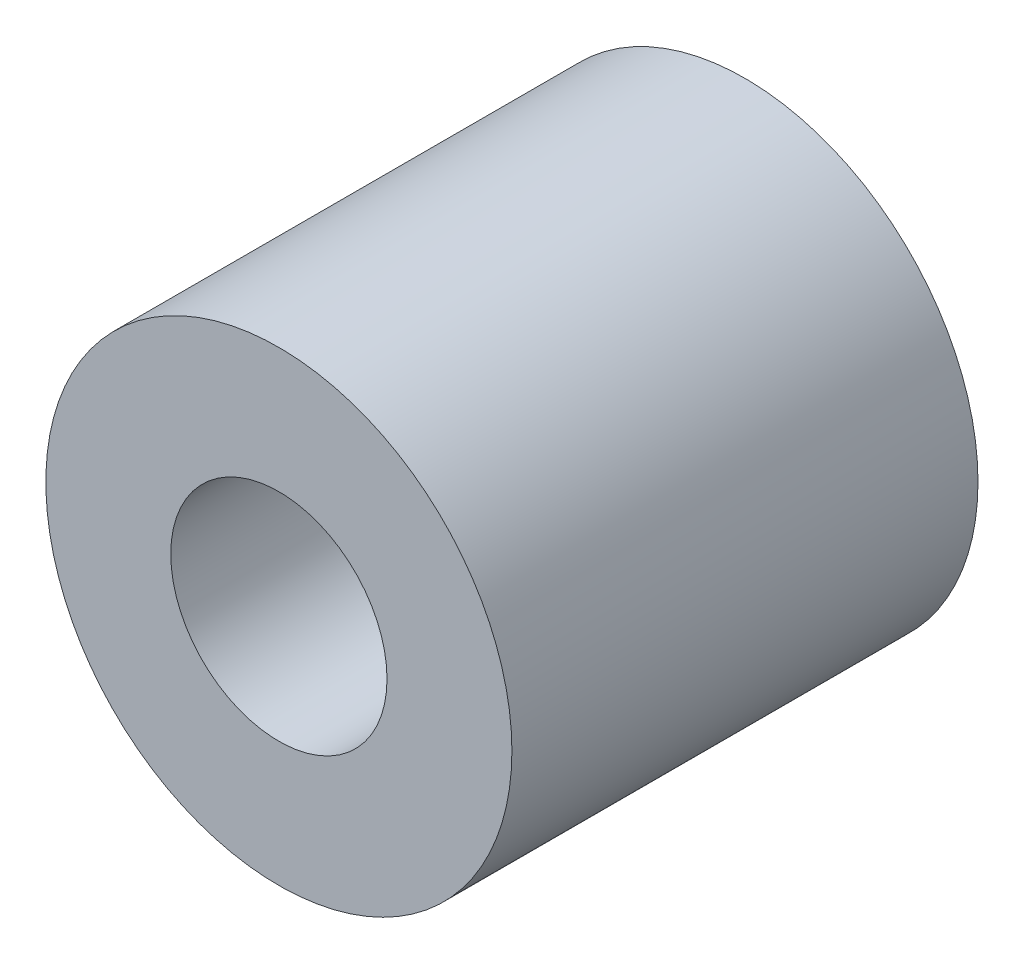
SolidWorks part; units mm, degrees
ref_plane "Front Plane" through (0, 0, 0) normal (0, 0, 1) x (1, 0, 0)
ref_plane "Top Plane" through (0, 0, 0) normal (0, 1, 0) x (1, 0, 0)
ref_plane "Right Plane" through (0, 0, 0) normal (1, 0, 0) x (0, 0, -1)
sketch "Sketch1" plane through (0, 0, 0) normal (0, 0, 1) x (1, 0, 0)
  circle A0 centre (0, 0) radius 3.175
  dimension "D1" = 6.35
extrude "Boss-Extrude1" add sketch "Sketch1" along normal blind 6.35
hole_wizard "#4 Clearance Hole1" positions "Sketch3" profile "Sketch2" hole size "#4" standard "ANSI Inch"
sketch "Sketch3" plane through (0, 0, 6.35) normal (0, 0, 1) x (1, 0, 0)
  point P0 (0, 0)
sketch "Sketch2" plane through (0, 0, 6.35) normal (1, 0, 0) x (0, -1, 0)
  line L0 (0, 0) -> (0, 6.35)
  line L1 (0, 6.35) -> (1.4732, 6.35)
  line L2 (1.4732, 6.35) -> (1.4732, 0)
  line L5 (1.4732, 0) -> (0, 0)
  line L11 (0, -6.35) -> (0, 107.95) construction
  dimension "Thru Hole Dia." = 2.9464
  dimension "Thru Hole Depth" = 6.35
